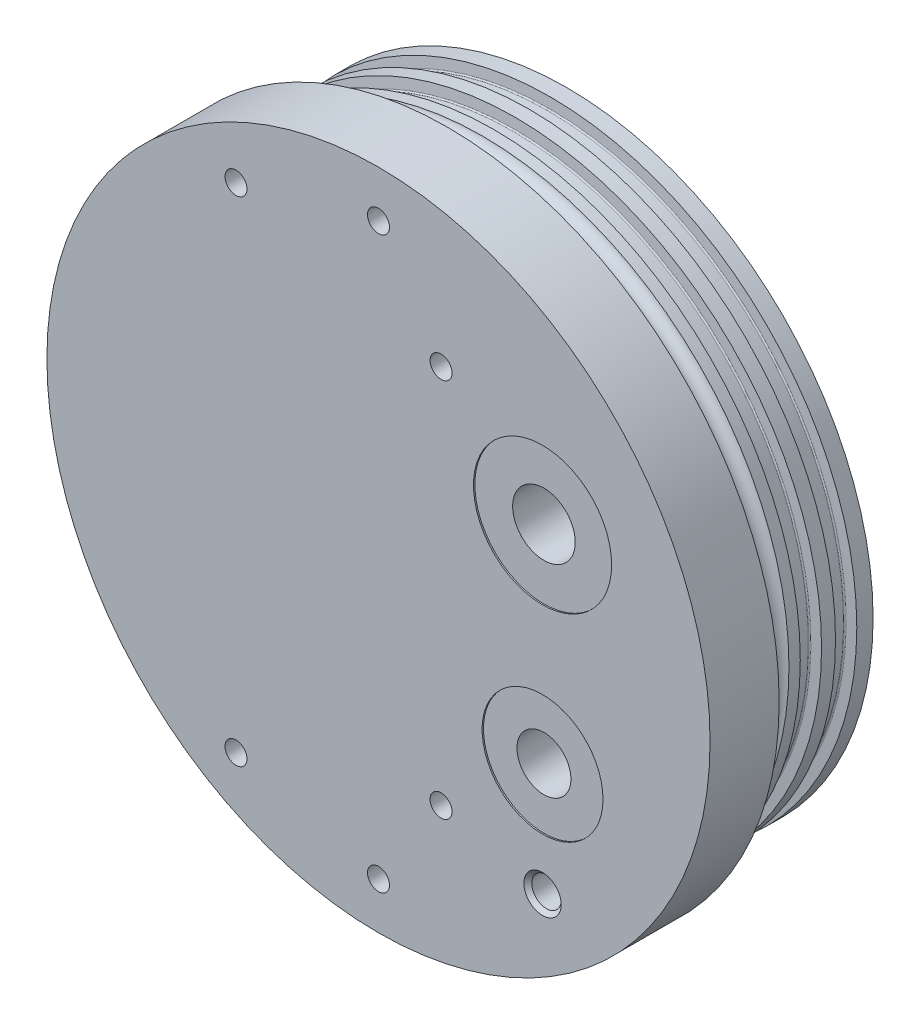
SolidWorks part; units mm, degrees
ref_plane "Front Plane" through (0, 0, 0) normal (0, 0, 1) x (1, 0, 0)
ref_plane "Top Plane" through (0, 0, 0) normal (0, 1, 0) x (1, 0, 0)
ref_plane "Right Plane" through (0, 0, 0) normal (1, 0, 0) x (0, 0, -1)
sketch "Sketch1" plane through (0, 0, 0) normal (0, 0, 1) x (1, 0, 0)
  circle A0 centre (0, 0) radius 60.96
  dimension "D1" = 121.92
extrude "Boss-Extrude1" add sketch "Sketch1" along normal blind 12.7
sketch "Sketch3" plane through (0, 0, 0) normal (1, 0, 0) x (0, 0, -1)
  line L0 (0, 56.7055) -> (0, 0)
  line L1 (0, -60.96) -> (0, 60.96) construction
  line L2 (8.5217, 56.3245) -> (8.6792, 54.5244)
  line L3 (8.9322, 54.2925) -> (12.0228, 54.2925)
  line L4 (12.2758, 54.5244) -> (12.4333, 56.3245)
  line L5 (12.4333, 56.3245) -> (14.9987, 56.3245)
  line L6 (14.9987, 56.3245) -> (15.1562, 54.5244)
  line L7 (15.4092, 54.2925) -> (18.4998, 54.2925)
  line L8 (18.7528, 54.5244) -> (18.9103, 56.3245)
  line L9 (18.9103, 56.3245) -> (21.9075, 56.3245)
  line L10 (21.9075, 56.3245) -> (21.9075, 50.8)
  line L11 (0, 56.7055) -> (2.667, 56.7055)
  line L12 (3.175, 39.9848) -> (3.175, 0)
  line L13 (3.175, 0) -> (0, 0)
  line L14 (0, 0) -> (-25.9396, 0) construction
  line L15 (18.7528, 54.5244) -> (18.7325, 54.2925) construction
  line L16 (-12.7, 60.96) -> (-12.7, -60.96) construction
  line L17 (21.9075, 50.8) -> (3.175, 39.9848)
  line L18 (6.4385, 56.3245) -> (8.5217, 56.3245)
  line L19 (15.1562, 54.5244) -> (15.1765, 54.2925) construction
  line L20 (12.2758, 54.5244) -> (12.2555, 54.2925) construction
  line L21 (8.6792, 54.5244) -> (8.6995, 54.2925) construction
  line L22 (18.4998, 54.2925) -> (18.7325, 54.2925) construction
  line L23 (15.4092, 54.2925) -> (15.1765, 54.2925) construction
  line L24 (12.0228, 54.2925) -> (12.2555, 54.2925) construction
  line L25 (8.9322, 54.2925) -> (8.6995, 54.2925) construction
  line L26 (18.7325, 54.2925) -> (18.7325, 57.3063) construction
  line L27 (12.2555, 54.2925) -> (12.2555, 57.0683) construction
  arc A0 (8.6792, 54.5244) -> (8.9322, 54.2925) centre (8.9322, 54.5465) ccw
  arc A1 (12.0228, 54.2925) -> (12.2758, 54.5244) centre (12.0228, 54.5465) ccw
  arc A2 (15.1562, 54.5244) -> (15.4092, 54.2925) centre (15.4092, 54.5465) ccw
  arc A3 (18.4998, 54.2925) -> (18.7528, 54.5244) centre (18.4998, 54.5465) ccw
  arc A4 (2.667, 56.7055) -> (6.4385, 56.3245) centre (4.572, 56.7055) ccw
  point P26 (15.1765, 54.2925)
  dimension "D5" = 10
  dimension "D11" = 3.81
  dimension "D18" = 0.254
  dimension "D2" = 108.585
  dimension "D3" = 15.875
  dimension "D4" = 5
  dimension "D6" = 0.381
  dimension "D7" = 5
  dimension "D8" = 10
  dimension "D9" = 60
  dimension "D10" = 50.8
  dimension "D12" = 4.572
  dimension "D13" = 112.649
  dimension "D14" = 113.411
  dimension "D15" = 21.9075
  dimension "D16" = 3.556
  dimension "D17" = 3.556
  dimension "D19" = 3.175
  dimension "D20" = 9.652
revolve "Revolve1" add sketch "Sketch3" angle 360 about L14
hole_wizard "7/16-20 Tapped Hole1" positions "Sketch5" profile "Sketch4" tap size "7/16-20" standard "Ansi Inch"
sketch "Sketch5" plane through (0, 0, 12.7) normal (0, 0, 1) x (1, 0, 0)
  point P11 (30.1625, -19.05)
  dimension "D1" = 30.1625
  dimension "D4" = 19.05
sketch "Sketch4" plane through (30.1625, -19.05, 12.7) normal (1, 0, 0) x (0, -1, 0)
  line L0 (0, 0) -> (0, 34.6075)
  line L1 (0, 34.6075) -> (4.9606, 34.6075)
  line L2 (4.9606, 34.6075) -> (4.9606, 0)
  line L5 (4.9606, 0) -> (0, 0)
  line L11 (0, -6.35) -> (0, 107.95) construction
  dimension "Thru Tap Drill Dia." = 9.9212
  dimension "Thru Tap Drill Depth" = 34.6075
hole_wizard "1/2-20 Tapped Hole1" positions "Sketch28" profile "Sketch27" tap size "1/2-20" standard "ANSI Inch"
sketch "Sketch28" plane through (0, 0, 12.7) normal (0, 0, 1) x (1, 0, 0)
  point P0 (30.1625, 19.05)
  dimension "D1" = 30.1625
  dimension "D2" = 19.05
sketch "Sketch27" plane through (30.1625, 19.05, 12.7) normal (1, 0, 0) x (0, -1, 0)
  line L0 (0, 0) -> (0, 34.6075)
  line L1 (0, 34.6075) -> (5.7544, 34.6075)
  line L2 (5.7544, 34.6075) -> (5.7544, 0)
  line L5 (5.7544, 0) -> (0, 0)
  line L11 (0, -6.35) -> (0, 107.95) construction
  dimension "Thru Tap Drill Dia." = 11.5087
  dimension "Thru Tap Drill Depth" = 34.6075
sketch "Sketch26" plane through (0, 0, 12.7) normal (0, 0, 1) x (1, 0, 0)
  circle A1 centre (30.1625, -19.05) radius 11.1125
  circle A4 centre (30.1625, 19.05) radius 12.7
  dimension "D1" = 22.225
  dimension "D2" = 25.4
extrude "Cut-Extrude1" cut sketch "Sketch26" against normal blind 0.254
hole_wizard "#10-32 Tapped Hole1" positions "Sketch7" profile "Sketch6" tap size "#10-32" standard "Ansi Inch"
sketch "Sketch7" plane through (0, 0, 12.7) normal (0, 0, 1) x (1, 0, 0)
  line L0 (0, 0) -> (0, -52.3875) construction
  circle A0 centre (0, 0) radius 52.3875 construction
  point P0 (0, -52.3875)
  dimension "D2" = 104.775
sketch "Sketch6" plane through (0, -52.3875, 12.7) normal (1, 0, 0) x (0, -1, 0)
  line L0 (0, 0) -> (0, 13.2529)
  line L1 (0, 13.2529) -> (2.0193, 12.0396)
  line L2 (2.0193, 12.0396) -> (2.0193, 0)
  line L5 (2.0193, 0) -> (0, 0)
  line L10 (0, 13.2529) -> (-2.0193, 12.0396) construction
  line L11 (0, -6.35) -> (0, 107.95) construction
  dimension "Tap Drill Dia." = 4.0386
  dimension "Tap Drill Depth" = 12.0396
  dimension "Drill Angle" = 118
pattern_circular "CirPattern1" count 24 over 360 of "#10-32 Tapped Hole1"
hole_wizard "#10-32 Tapped Hole2" positions "Sketch9" profile "Sketch8" tap size "#10-32" standard "Ansi Inch"
sketch "Sketch9" plane through (0, 0, 12.7) normal (0, 0, 1) x (1, 0, 0)
  point P0 (11.5062, 34.925)
  point P1 (11.5062, -34.925)
  dimension "D1" = 11.5062
  dimension "D2" = 34.925
  dimension "D3" = 34.925
sketch "Sketch8" plane through (11.5062, 34.925, 12.7) normal (1, 0, 0) x (0, -1, 0)
  line L0 (0, 0) -> (0, 13.2529)
  line L1 (0, 13.2529) -> (2.0193, 12.0396)
  line L2 (2.0193, 12.0396) -> (2.0193, 0)
  line L5 (2.0193, 0) -> (0, 0)
  line L10 (0, 13.2529) -> (-2.0193, 12.0396) construction
  line L11 (0, -6.35) -> (0, 107.95) construction
  dimension "Tap Drill Dia." = 4.0386
  dimension "Tap Drill Depth" = 12.0396
  dimension "Drill Angle" = 118
hole_wizard ".25-28 middle" positions "Sketch22" profile "Sketch23" legacy
sketch "Sketch22" plane through (15.327, -77.096, 12.7) normal (0, 0, 1) x (1, 0, 0)
  circle A1 centre (-15.327, 77.096) radius 60.96 construction
  point P0 (14.8355, 37.4085)
  dimension "D1" = 39.6875
  dimension "D2" = 30.1625
sketch "Sketch23" plane through (30.1625, -39.6875, 12.7) normal (1, 0, 0) x (0, -1, 0)
  line L0 (-2.7051, 8.89) -> (-2.7051, 0.7239) construction
  line L1 (0, 8.89) -> (2.7051, 8.89)
  line L2 (0, 0) -> (0, -3.5564) construction
  line L3 (0, 8.89) -> (0, 0)
  line L4 (2.7051, 8.89) -> (2.7051, 0.7239)
  line L5 (2.7051, 0.7239) -> (3.429, 0)
  line L6 (3.429, 0) -> (0, 0)
hole_wizard "1/16 (0.0625) Diameter Hole1" positions "Sketch25" profile "Sketch24" hole size "1/16" standard "Ansi Inch"
sketch "Sketch25" plane through (29.248, 2.0524, 3.81) normal (0, 0, 1) x (1, 0, 0)
  point P0 (0.9145, -41.7399)
sketch "Sketch24" plane through (30.1625, -39.6875, 3.81) normal (1, 0, 0) x (0, -1, 0)
  line L0 (0, 0) -> (0, 25.7175)
  line L1 (0, 25.7175) -> (0.7937, 25.7175)
  line L2 (0.7937, 25.7175) -> (0.7937, 0)
  line L5 (0.7937, 0) -> (0, 0)
  line L11 (0, -6.35) -> (0, 107.95) construction
  dimension "Thru Hole Dia." = 1.5875
  dimension "Thru Hole Depth" = 25.7175
other "Flat Bottom-.25-28<1>"
equation "\"Buoyancy\"=\"SW-Volume\"*(\"SW-Density\"-.037062)"
